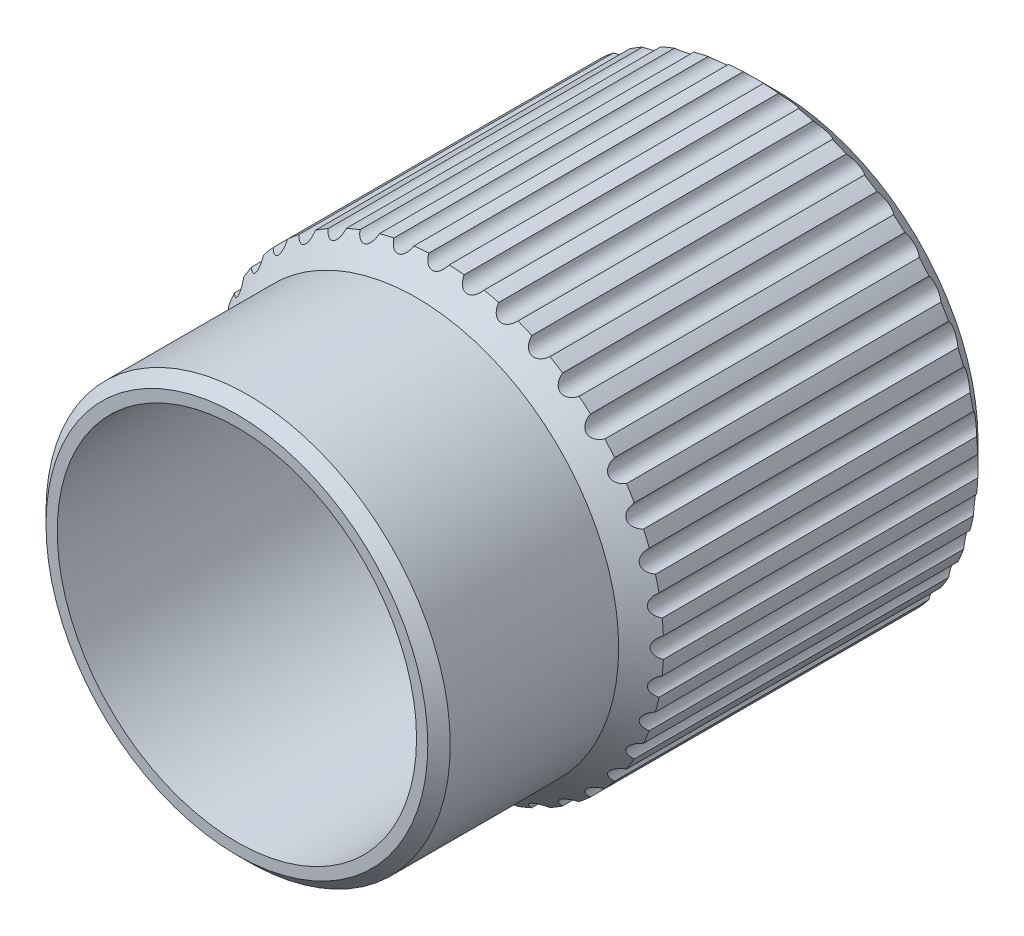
SolidWorks part; units mm, degrees
ref_plane "Plan de face" through (0, 0, 0) normal (0, 0, 1) x (1, 0, 0)
ref_plane "Plan de dessus" through (0, 0, 0) normal (0, 1, 0) x (1, 0, 0)
ref_plane "Plan de droite" through (0, 0, 0) normal (1, 0, 0) x (0, 0, -1)
sketch "Esquisse1" plane through (0, 0, 0) normal (0, 0, 1) x (1, 0, 0)
  circle A0 centre (0, 0) radius 10
  dimension "D1" = 20
extrude "Extrusion1" add sketch "Esquisse1" along normal blind 16
sketch "Esquisse2" plane through (0, 0, 16) normal (0, 0, 1) x (1, 0, 0)
  circle A0 centre (0, 0) radius 9
  dimension "D1" = 18
extrude "Extrusion2" add sketch "Esquisse2" along normal blind 8
sketch "Esquisse3" plane through (0, 0, 24) normal (0, 0, 1) x (1, 0, 0)
  circle A0 centre (0, 0) radius 8
extrude "Enlèv. mat.-Extru.1" cut sketch "Esquisse3" against normal blind 13
sketch "Esquisse4" plane through (0, 0, 11) normal (0, 0, 1) x (1, 0, 0)
  circle A0 centre (0, 0) radius 2
extrude "Enlèv. mat.-Extru.2" cut sketch "Esquisse4" against normal through all
sketch "Esquisse5" plane through (0, 0, 0) normal (0, 0, -1) x (-1, 0, 0)
  circle A0 centre (0, 0) radius 4.25
extrude "Enlèv. mat.-Extru.3" cut sketch "Esquisse5" against normal blind 3
chamfer "Chanfrein1" distance 1 angle 45 2 edges at (10, 0, 0) (10, 0, 16)
chamfer "Chanfrein2" distance 0.5 angle 45 1 edges at (9, 0, 24)
sketch "Esquisse6" plane through (0, 0, 0) normal (0, 0, -1) x (-1, 0, 0)
  circle A0 centre (0, 10.2) radius 0.5
  circle A2 centre (1.5956, 10.0744) radius 0.5
  circle A3 centre (3.152, 9.7008) radius 0.5
  circle A4 centre (4.6307, 9.0883) radius 0.5
  circle A5 centre (5.9954, 8.252) radius 0.5
  circle A6 centre (7.2125, 7.2125) radius 0.5
  circle A7 centre (8.252, 5.9954) radius 0.5
  circle A8 centre (9.0883, 4.6307) radius 0.5
  circle A9 centre (9.7008, 3.152) radius 0.5
  circle A10 centre (10.0744, 1.5956) radius 0.5
  circle A11 centre (10.2, 0) radius 0.5
  circle A12 centre (10.0744, -1.5956) radius 0.5
  circle A13 centre (9.7008, -3.152) radius 0.5
  circle A14 centre (9.0883, -4.6307) radius 0.5
  circle A15 centre (8.252, -5.9954) radius 0.5
  circle A16 centre (7.2125, -7.2125) radius 0.5
  circle A17 centre (5.9954, -8.252) radius 0.5
  circle A18 centre (4.6307, -9.0883) radius 0.5
  circle A19 centre (3.152, -9.7008) radius 0.5
  circle A20 centre (1.5956, -10.0744) radius 0.5
  circle A21 centre (0, -10.2) radius 0.5
  circle A22 centre (-1.5956, -10.0744) radius 0.5
  circle A23 centre (-3.152, -9.7008) radius 0.5
  circle A24 centre (-4.6307, -9.0883) radius 0.5
  circle A25 centre (-5.9954, -8.252) radius 0.5
  circle A26 centre (-7.2125, -7.2125) radius 0.5
  circle A27 centre (-8.252, -5.9954) radius 0.5
  circle A28 centre (-9.0883, -4.6307) radius 0.5
  circle A29 centre (-9.7008, -3.152) radius 0.5
  circle A30 centre (-10.0744, -1.5956) radius 0.5
  circle A31 centre (-10.2, 0) radius 0.5
  circle A32 centre (-10.0744, 1.5956) radius 0.5
  circle A33 centre (-9.7008, 3.152) radius 0.5
  circle A34 centre (-9.0883, 4.6307) radius 0.5
  circle A35 centre (-8.252, 5.9954) radius 0.5
  circle A36 centre (-7.2125, 7.2125) radius 0.5
  circle A37 centre (-5.9954, 8.252) radius 0.5
  circle A38 centre (-4.6307, 9.0883) radius 0.5
  circle A39 centre (-3.152, 9.7008) radius 0.5
  circle A40 centre (-1.5956, 10.0744) radius 0.5
  dimension "D1" = 1
  dimension "D2" = 10.2
extrude "Enlèv. mat.-Extru.4" cut sketch "Esquisse6" against normal blind 20
